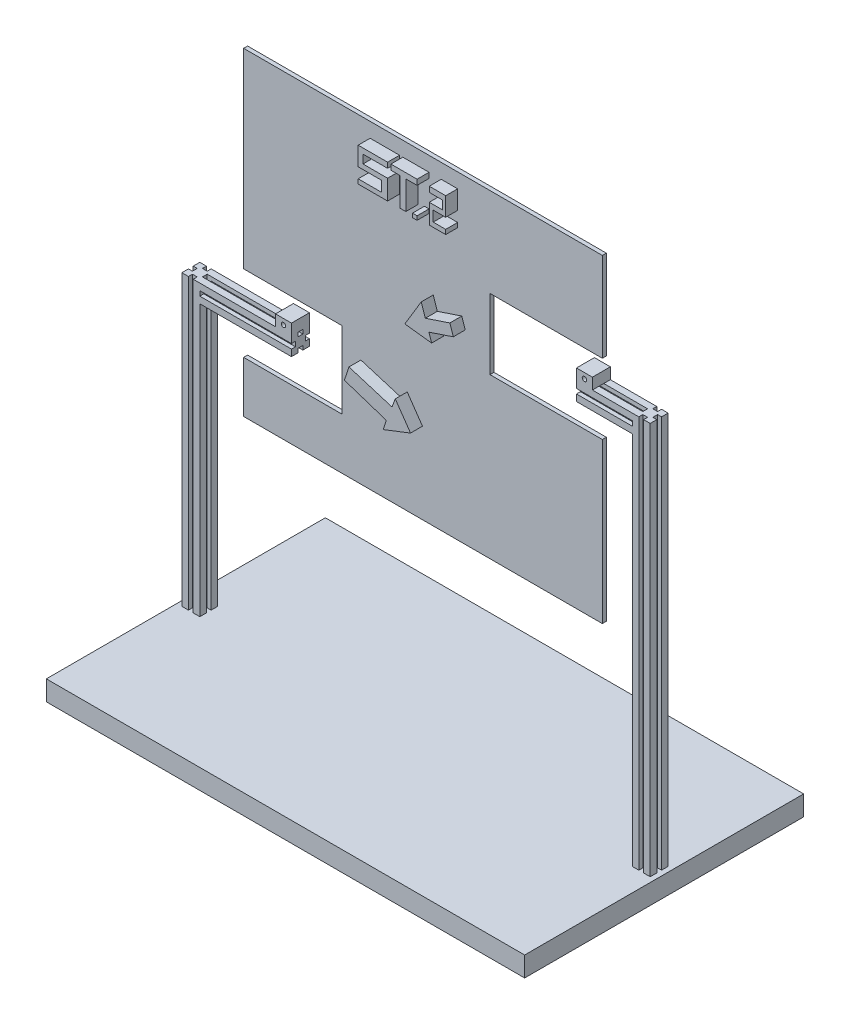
SolidWorks part; units mm, degrees
ref_plane "Front Plane" through (0, 0, 0) normal (0, 0, 1) x (1, 0, 0)
ref_plane "Top Plane" through (0, 0, 0) normal (0, 1, 0) x (1, 0, 0)
ref_plane "Right Plane" through (0, 0, 0) normal (1, 0, 0) x (0, 0, -1)
sketch "Schizzo1" plane through (0, 0, 0) normal (0, 1, 0) x (1, 0, 0)
  line L1 (-600, 350) -> (600, 350)
  line L2 (-600, 350) -> (-600, -350)
  line L3 (-600, -350) -> (600, -350)
  line L4 (600, 350) -> (600, -350)
  dimension "D1" = 1200
  dimension "D2" = 600
  dimension "D3" = 700
  dimension "D4" = 350
extrude "Estrusione-Estrusione1" add sketch "Schizzo1" along normal blind 50
sketch "Schizzo2" plane through (0, 50, 0) normal (0, 1, 0) x (1, 0, 0)
  line L0 (-600, -350) -> (600, -350) construction
  line L1 (-587.5, 22.5) -> (-542.5, 22.5)
  line L2 (-587.5, 22.5) -> (-587.5, -22.5)
  line L3 (-587.5, -22.5) -> (-542.5, -22.5)
  line L4 (-542.5, 22.5) -> (-542.5, -22.5)
  line L5 (471.3786, 22.5) -> (516.3786, 22.5)
  line L6 (471.3786, 22.5) -> (471.3786, -22.5)
  line L7 (471.3786, -22.5) -> (516.3786, -22.5)
  line L8 (516.3786, 22.5) -> (516.3786, -22.5)
  line L10 (-566.6655, 0) -> (-477.0291, 0) construction
  line L11 (-565, -38.8225) -> (-565, 33.5547) construction
  line L12 (-559, 22.5) -> (-559, 12.5)
  line L13 (-571, -22.5) -> (-559, -22.5)
  line L14 (-571, -22.5) -> (-571, -12.5)
  line L15 (-571, -12.5) -> (-559, -12.5)
  line L16 (-559, -22.5) -> (-559, -12.5)
  line L17 (-587.5, 6) -> (-577.5, 6)
  line L18 (-587.5, 6) -> (-587.5, -6)
  line L19 (-587.5, -6) -> (-577.5, -6)
  line L20 (-577.5, 6) -> (-577.5, -6)
  line L21 (-571, 22.5) -> (-571, 12.5)
  line L22 (-571, 12.5) -> (-559, 12.5)
  line L23 (-542.5, -6) -> (-552.5, -6)
  line L24 (-552.5, 6) -> (-552.5, -6)
  line L25 (-542.5, 6) -> (-552.5, 6)
  dimension "D1" = 45
  dimension "D2" = 45
  dimension "D3" = 45
  dimension "D4" = 45
  dimension "D5" = 327.5
  dimension "D6" = 327.5
  dimension "D7" = 22.5
  dimension "D8" = 12
  dimension "D9" = 6
  dimension "D10" = 10
  dimension "D11" = 10
  dimension "D12" = 12
  dimension "D13" = 6
  dimension "D14" = 587.5
extrude "Estrusione-Estrusione2" add sketch "Schizzo2" along normal blind 680 and the other way blind 45 from offset 45 separate body contours L25 L4 L1 L12 L22 L21 L2 L17 L20 L19 L3 L14 L15 L16 L23 L24
sketch "Schizzo3" plane through (0, 50, 0) normal (0, 1, 0) x (1, 0, 0)
  line L0 (-600, -350) -> (600, -350) construction
  line L1 (542.5, 22.5) -> (587.5, 22.5)
  line L2 (542.5, 22.5) -> (542.5, -22.5)
  line L3 (542.5, -22.5) -> (587.5, -22.5)
  line L4 (587.5, 22.5) -> (587.5, -22.5)
  line L5 (565, 30.9791) -> (565, -29.5813) construction
  line L6 (530.3703, 0) -> (597.2458, 0) construction
  line L7 (542.5, -6) -> (552.5, -6)
  line L8 (559, -22.5) -> (571, -22.5)
  line L9 (559, -22.5) -> (559, -12.5)
  line L10 (559, -12.5) -> (571, -12.5)
  line L11 (571, -22.5) -> (571, -12.5)
  line L12 (587.5, 6) -> (577.5, 6)
  line L13 (587.5, 6) -> (587.5, -6)
  line L14 (587.5, -6) -> (577.5, -6)
  line L15 (577.5, 6) -> (577.5, -6)
  line L16 (552.5, 6) -> (552.5, -6)
  line L17 (542.5, 6) -> (552.5, 6)
  line L18 (571, 22.5) -> (571, 12.5)
  line L19 (559, 12.5) -> (571, 12.5)
  line L20 (559, 22.5) -> (559, 12.5)
  dimension "D1" = 45
  dimension "D2" = 45
  dimension "D3" = 587.5
  dimension "D4" = 327.5
  dimension "D5" = 22.5
  dimension "D6" = 22.5
  dimension "D7" = 12
  dimension "D8" = 10
  dimension "D9" = 10
  dimension "D10" = 12
  dimension "D11" = 6
  dimension "D12" = 6
extrude "Estrusione-Estrusione3" add sketch "Schizzo3" along normal blind 985 separate body contours L20 L1 L2 L17 L16 L7 L3 L9 L10 L11 L4 L14 L15 L12 L18 L19
sketch "Schizzo4" plane through (-542.5, 0, 0) normal (1, 0, 0) x (0, 0, -1)
  line L0 (22.5, 50) -> (22.5, 775) construction
  line L1 (-22.5, 775) -> (22.5, 775)
  line L2 (-22.5, 775) -> (-22.5, 730)
  line L3 (-22.5, 730) -> (22.5, 730)
  line L4 (22.5, 775) -> (22.5, 730)
  line L5 (6, 50) -> (6, 775) construction
  line L6 (-22.5, 758.5) -> (-12.5, 758.5)
  line L7 (-22.5, 758.5) -> (-22.5, 746.5)
  line L8 (-22.5, 746.5) -> (-12.5, 746.5)
  line L9 (-12.5, 758.5) -> (-12.5, 746.5)
  line L10 (22.5, 758.5) -> (12.5, 758.5)
  line L11 (22.5, 758.5) -> (22.5, 746.5)
  line L12 (22.5, 746.5) -> (12.5, 746.5)
  line L13 (12.5, 758.5) -> (12.5, 746.5)
  line L14 (-6, 775) -> (6, 775)
  line L15 (-6, 775) -> (-6, 765)
  line L16 (-6, 765) -> (6, 765)
  line L17 (6, 775) -> (6, 765)
  line L18 (-6, 50) -> (-6, 775) construction
  line L19 (-6, 730) -> (6, 730)
  line L20 (-6, 730) -> (-6, 740)
  line L21 (-6, 740) -> (6, 740)
  line L22 (6, 730) -> (6, 740)
  dimension "D1" = 45
  dimension "D2" = 10
  dimension "D3" = 12
  dimension "D4" = 10
  dimension "D5" = 12
  dimension "D6" = 10
  dimension "D7" = 10
  dimension "D8" = 16.5
  dimension "D9" = 16.5
extrude "Estrusione-Estrusione4" add sketch "Schizzo4" along normal blind 230 contours L22 L3 L4 L12 L13 L10 L1 L17 L16 L21 M1 | L6 L9 L8 L3 M3 M1 M2
sketch "Schizzo5" plane through (0, 775, 0) normal (0, 1, 0) x (1, 0, 0)
  line L0 (-559, -22.5) -> (-312.5, -22.5) construction
  line L1 (-312.5, 22.5) -> (-352.5, 22.5)
  line L2 (-312.5, 22.5) -> (-312.5, -22.5)
  line L3 (-312.5, -22.5) -> (-352.5, -22.5)
  line L4 (-352.5, 22.5) -> (-352.5, -22.5)
  dimension "D1" = 40
extrude "Estrusione-Estrusione5" add sketch "Schizzo5" along normal blind 28
sketch "Schizzo6" plane through (0, 0, 22.5) normal (0, 0, 1) x (1, 0, 0)
  line L0 (-352.5, 803) -> (-312.5, 803) construction
  line L1 (-352.5, 803) -> (-352.5, 775) construction
  circle A0 centre (-332.5, 789) radius 5.5
  dimension "D1" = 11
  dimension "D2" = 14
  dimension "D3" = 20
extrude "Taglio-Estrusione1" cut sketch "Schizzo6" against normal blind 45
sketch "Schizzo7" plane through (542.5, 0, 0) normal (-1, 0, 0) x (0, 0, 1)
  line L0 (22.5, 1035) -> (22.5, 50) construction
  line L1 (-22.5, 1035) -> (22.5, 1035)
  line L2 (-22.5, 1035) -> (-22.5, 990)
  line L3 (-22.5, 990) -> (22.5, 990)
  line L4 (22.5, 1035) -> (22.5, 990)
  line L5 (6, 1035) -> (6, 50) construction
  line L6 (22.5, 1018.5) -> (12.5, 1018.5)
  line L7 (22.5, 1018.5) -> (22.5, 1006.5)
  line L8 (22.5, 1006.5) -> (12.5, 1006.5)
  line L9 (12.5, 1018.5) -> (12.5, 1006.5)
  line L10 (-22.5, 1018.5) -> (-12.5, 1018.5)
  line L11 (-22.5, 1018.5) -> (-22.5, 1006.5)
  line L12 (-22.5, 1006.5) -> (-12.5, 1006.5)
  line L13 (-12.5, 1018.5) -> (-12.5, 1006.5)
  line L14 (-6, 1035) -> (6, 1035)
  line L15 (-6, 1035) -> (-6, 1025)
  line L16 (-6, 1025) -> (6, 1025)
  line L17 (6, 1035) -> (6, 1025)
  line L18 (-6, 1035) -> (-6, 50) construction
  line L19 (-6, 990) -> (6, 990)
  line L20 (-6, 990) -> (-6, 1000)
  line L21 (-6, 1000) -> (6, 1000)
  line L22 (6, 990) -> (6, 1000)
  dimension "D1" = 45
  dimension "D2" = 10
  dimension "D3" = 10
  dimension "D4" = 12
  dimension "D5" = 12
  dimension "D6" = 10
  dimension "D7" = 10
  dimension "D8" = 16.5
  dimension "D9" = 16.5
extrude "Estrusione-Estrusione6" add sketch "Schizzo7" along normal blind 140 contours L9 L6 L4 L3 L8 M3 M4 M2 | L20 L21 L16 L15 L1 L2 L10 L13 L12 L3 M4
sketch "Schizzo8" plane through (0, 1035, 0) normal (0, 1, 0) x (1, 0, 0)
  line L0 (402.5, -22.5) -> (559, -22.5) construction
  line L1 (402.5, 22.5) -> (442.5, 22.5)
  line L2 (402.5, 22.5) -> (402.5, -22.5)
  line L3 (402.5, -22.5) -> (442.5, -22.5)
  line L4 (442.5, 22.5) -> (442.5, -22.5)
  dimension "D1" = 40
extrude "Estrusione-Estrusione7" add sketch "Schizzo8" along normal blind 28
sketch "Schizzo9" plane through (0, 0, 22.5) normal (0, 0, 1) x (1, 0, 0)
  line L0 (442.5, 1063) -> (442.5, 1035) construction
  line L1 (402.5, 1063) -> (442.5, 1063) construction
  circle A0 centre (422.5, 1049) radius 5.5
  dimension "D1" = 11
  dimension "D2" = 20
  dimension "D3" = 14
extrude "Taglio-Estrusione2" cut sketch "Schizzo9" against normal blind 45
sketch "Schizzo10" plane through (0, 0, 22.5) normal (0, 0, 1) x (1, 0, 0)
  line L0 (-600, 50) -> (600, 50) construction
  line L1 (-422.5523, 1350) -> (477.4477, 1350)
  line L2 (-422.5523, 1350) -> (-422.5523, 870.8352)
  line L3 (-422.5523, 550) -> (477.4477, 550)
  line L4 (477.4477, 1350) -> (477.4477, 1126.471)
  line L5 (477.4477, 1126.471) -> (195.4244, 1126.471)
  line L6 (195.4244, 1126.471) -> (195.4244, 950)
  line L7 (195.4244, 950) -> (477.4477, 950)
  line L8 (-422.5523, 870.8352) -> (-175.1303, 870.8352)
  line L9 (-175.1303, 870.8352) -> (-175.1303, 678.522)
  line L10 (-175.1303, 678.522) -> (-422.5523, 678.522)
  line L11 (477.4477, 950) -> (477.4477, 550)
  line L12 (-422.5523, 678.522) -> (-422.5523, 550)
  dimension "D1" = 1300
  dimension "D2" = 800
  dimension "D3" = 900
extrude "Estrusione-Estrusione8" add sketch "Schizzo10" along normal blind 10 separate body
sketch "Schizzo11" plane through (0, 0, 32.5) normal (0, 0, 1) x (1, 0, 0)
  line L0 (-105.1452, 1313.2239) -> (-31.39, 1313.2239)
  line L1 (-31.39, 1313.2239) -> (-31.39, 1299.8139)
  line L2 (-31.39, 1299.8139) -> (-93.0762, 1299.8139)
  line L3 (-93.0762, 1299.8139) -> (-93.0762, 1278.3578)
  line L4 (-93.0762, 1278.3578) -> (-31.39, 1278.3578)
  line L5 (-31.39, 1278.3578) -> (-31.39, 1228.7408)
  line L6 (-31.39, 1228.7408) -> (-105.1452, 1228.7408)
  line L7 (0, 1228.7408) -> (14.3592, 1228.7408)
  line L8 (-105.1452, 1240.1393) -> (-46.1411, 1240.1393)
  line L9 (-46.1411, 1240.1393) -> (-46.1411, 1266.2888)
  line L10 (-46.1411, 1266.2888) -> (-105.1452, 1266.2888)
  line L11 (-105.1452, 1313.2239) -> (-105.1452, 1266.2888)
  line L12 (-105.1452, 1240.1393) -> (-105.1452, 1228.7408)
  line L13 (14.3592, 1228.7408) -> (14.3592, 1299.8139)
  line L14 (14.3592, 1299.8139) -> (42.6162, 1299.8139)
  line L15 (42.6162, 1299.8139) -> (42.6162, 1313.2239)
  line L16 (42.6162, 1313.2239) -> (-23.0621, 1313.2239)
  line L17 (-23.0621, 1313.2239) -> (-23.0621, 1299.8139)
  line L18 (-23.0621, 1299.8139) -> (0, 1299.8139)
  line L19 (0, 1299.8139) -> (0, 1228.7408)
  line L20 (73.1642, 1313.2239) -> (73.1642, 1299.8139)
  line L21 (31.1606, 1233.719) -> (42.6162, 1233.719)
  line L22 (31.1606, 1233.719) -> (31.1606, 1223.7909)
  line L23 (31.1606, 1223.7909) -> (42.6162, 1223.7909)
  line L24 (42.6162, 1233.719) -> (42.6162, 1223.7909)
  line L25 (73.1642, 1299.8139) -> (106.767, 1299.8139)
  line L26 (106.767, 1299.8139) -> (106.767, 1278.3578)
  line L27 (106.767, 1278.3578) -> (73.1642, 1278.3578)
  line L28 (73.1642, 1278.3578) -> (73.1642, 1228.7408)
  line L29 (73.1642, 1228.7408) -> (114.404, 1228.7408)
  line L31 (114.404, 1240.1393) -> (83.0923, 1240.1393)
  line L32 (83.0923, 1240.1393) -> (83.0923, 1266.2888)
  line L33 (83.0923, 1266.2888) -> (114.404, 1266.2888)
  line L34 (114.404, 1266.2888) -> (114.404, 1313.2239)
  line L35 (114.404, 1313.2239) -> (73.1642, 1313.2239)
  line L36 (114.404, 1228.7408) -> (114.404, 1240.1393)
extrude "Estrusione-Estrusione9" add sketch "Schizzo11" along normal blind 30
sketch "Schizzo12" plane through (0, 0, 32.5) normal (0, 0, 1) x (1, 0, 0)
  line L0 (63.411, 1021.4711) -> (124.8195, 1041.9406)
  line L1 (124.8195, 1041.9406) -> (133.4347, 1016.095)
  line L2 (133.4347, 1016.095) -> (72.1633, 995.6712)
  line L3 (79.0599, 975.3411) -> (72.1633, 995.6712)
  line L4 (79.0599, 975.3411) -> (11.9351, 983.3992)
  line L5 (11.9351, 983.3992) -> (53.1019, 1051.8602)
  line L6 (63.411, 1021.4711) -> (53.1019, 1051.8602)
extrude "Estrusione-Estrusione10" add sketch "Schizzo12" along normal blind 30
sketch "Schizzo13" plane through (0, 0, 32.5) normal (0, 0, 1) x (1, 0, 0)
  line L0 (-139.7027, 785.243) -> (-34.4781, 750.6692)
  line L1 (-128.3428, 819.8168) -> (-20.3651, 786.8528)
  line L2 (-42.1346, 726.7695) -> (-34.4781, 750.6692)
  line L3 (-128.3428, 819.8168) -> (-139.7027, 785.243)
  line L4 (-12.0845, 808.6191) -> (-20.3651, 786.8528)
  line L5 (-42.1346, 726.7695) -> (26.179, 753.3359)
  line L6 (26.179, 753.3359) -> (-12.0845, 808.6191)
extrude "Estrusione-Estrusione11" add sketch "Schizzo13" along normal blind 30
